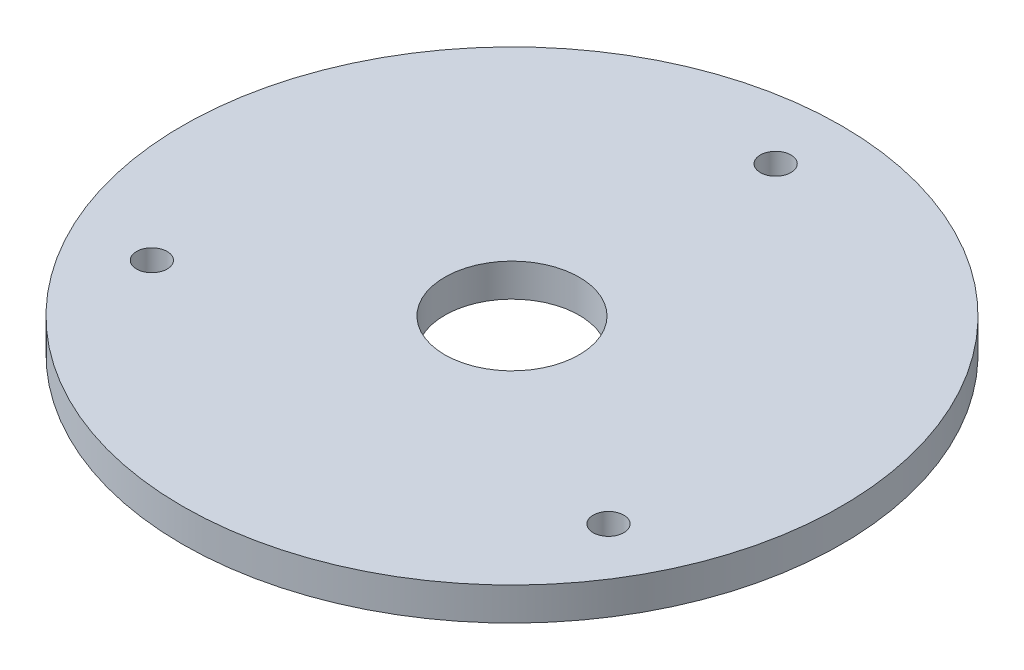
SolidWorks part; units mm, degrees
ref_plane "Front Plane" through (0, 0, 0) normal (0, 0, 1) x (1, 0, 0)
ref_plane "Top Plane" through (0, 0, 0) normal (0, 1, 0) x (1, 0, 0)
ref_plane "Right Plane" through (0, 0, 0) normal (1, 0, 0) x (0, 0, -1)
sketch "Sketch1" plane through (0, 0, 0) normal (0, 1, 0) x (1, 0, 0)
  circle A0 centre (0, 0) radius 6.477
  circle A1 centre (0, 0) radius 31.75
  dimension "D1" = 12.954
  dimension "D2" = 63.5
extrude "Boss-Extrude1" add sketch "Sketch1" along normal blind 3.175
sketch "Sketch2" plane through (0, 3.175, 0) normal (0, 1, 0) x (1, 0, 0)
  line L0 (0, 0) -> (0, 25.4) construction
  circle A0 centre (0, 0) radius 25.4 construction
  circle A1 centre (0, 25.4) radius 1.4732
  circle A2 centre (21.997, -12.7) radius 1.4732
  circle A3 centre (-21.997, -12.7) radius 1.4732
  dimension "D1" = 50.8
  dimension "D2" = 2.9464
  dimension "D4" = 25.4
  dimension "D3" = 3
extrude "Cut-Extrude1" cut sketch "Sketch2" against normal through all
